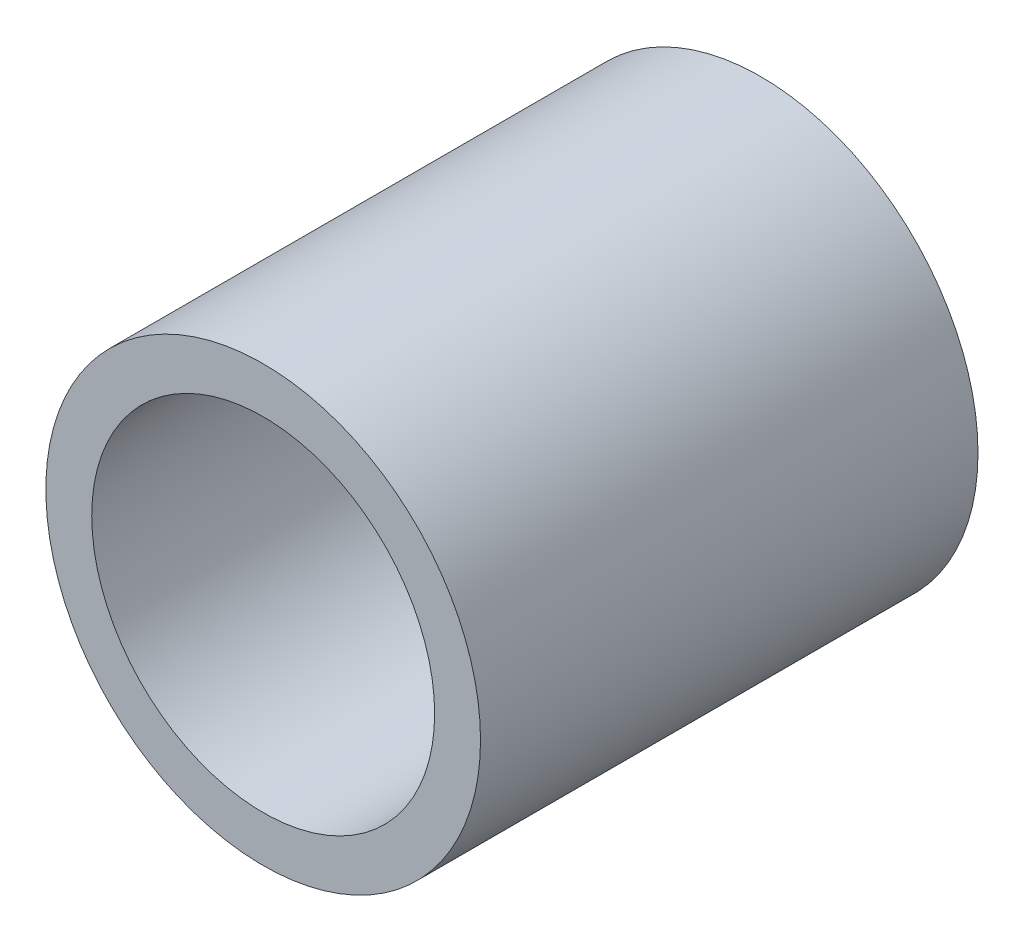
SolidWorks part; units mm, degrees
ref_plane "Přední rovina" through (0, 0, 0) normal (0, 0, 1) x (1, 0, 0)
ref_plane "Horní rovina" through (0, 0, 0) normal (0, 1, 0) x (1, 0, 0)
ref_plane "Pravá rovina" through (0, 0, 0) normal (1, 0, 0) x (0, 0, -1)
sketch "Skica1" plane through (0, 0, 0) normal (0, 0, 1) x (1, 0, 0)
  line L0 (0, 0) -> (37.8479, 0) construction
  line L2 (0, 37.8479) -> (0, 0) construction
  circle A0 centre (0, 0) radius 22.5
  dimension "D1" = 45
extrude "Přidat vysunutím1" add sketch "Skica1" along normal blind 51.5
sketch "Skica2" plane through (0, 0, 51.5) normal (0, 0, 1) x (1, 0, 0)
  circle A0 centre (0, 0) radius 17.75
  dimension "D1" = 35.5
extrude "Odebrat vysunutím1" cut sketch "Skica2" against normal blind 51.5
